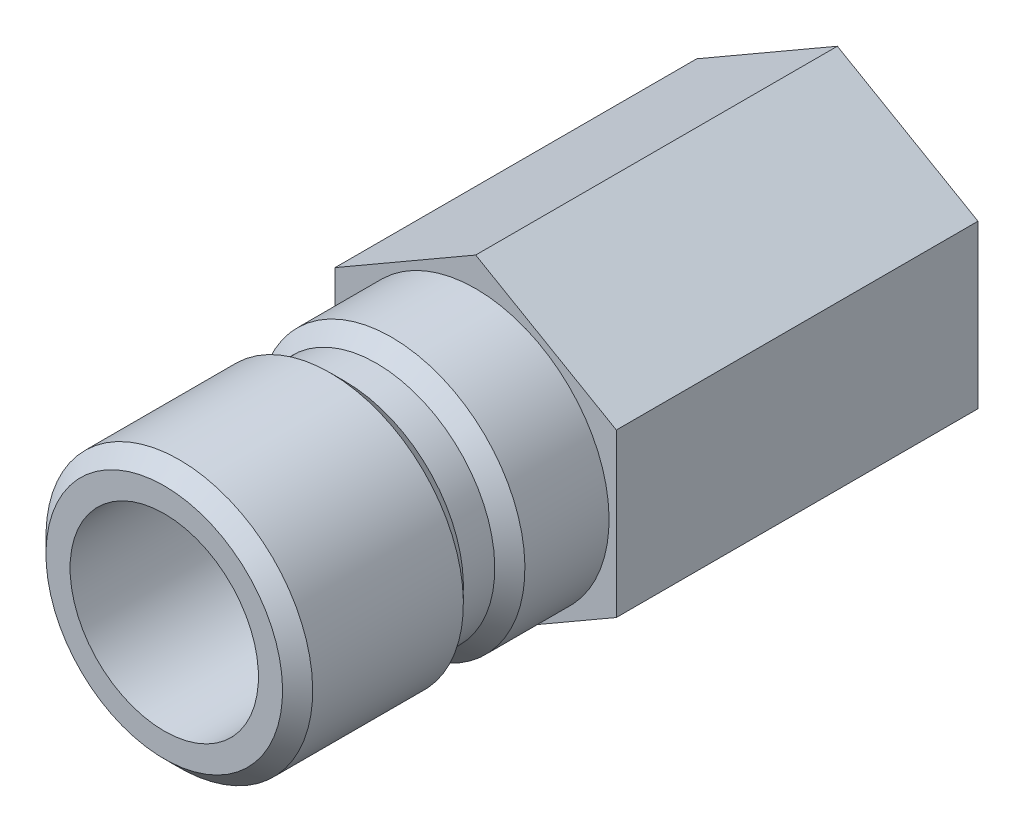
SolidWorks part; units mm, degrees
ref_plane "Front Plane" through (0, 0, 0) normal (0, 0, 1) x (1, 0, 0)
ref_plane "Top Plane" through (0, 0, 0) normal (0, 1, 0) x (1, 0, 0)
ref_plane "Right Plane" through (0, 0, 0) normal (1, 0, 0) x (0, 0, -1)
sketch "Sketch1" plane through (0, 0, 0) normal (1, 0, 0) x (0, 0, -1)
  line L0 (0, 0) -> (-18.923, 0) construction
  line L1 (-15.748, 4.7625) -> (-15.748, 5.9817)
  line L2 (-6.604, 5.9817) -> (-6.604, 0) construction
  line L3 (-14.986, 6.7437) -> (-7.366, 6.7437)
  line L4 (0, 8.7312) -> (0, 0) construction
  line L5 (-6.604, 5.9817) -> (-5.0165, 5.9817)
  line L6 (-4.2545, 6.7437) -> (0, 6.7437)
  line L7 (0, 6.7437) -> (0, 8.7312)
  line L8 (-6.604, 5.9817) -> (-7.366, 6.7437)
  line L9 (-5.0165, 5.9817) -> (-4.2545, 6.7437)
  line L10 (-15.748, 5.9817) -> (-14.986, 6.7437)
  line L11 (-15.748, 4.7625) -> (6.6675, 4.7625)
  line L12 (0, 8.7312) -> (18.288, 8.7312)
  line L13 (6.6675, 4.7625) -> (6.6675, 5.588)
  line L14 (18.288, 8.7312) -> (18.288, 5.9511)
  line L15 (6.6675, 5.588) -> (18.288, 5.9511)
  dimension "D1" = 15.748
  dimension "D2" = 1.5875
  dimension "D3" = 0.762
  dimension "D4" = 45
  dimension "D5" = 9.144
  dimension "D6" = 45
  dimension "D7" = 17.4625
  dimension "D8" = 9.525
  dimension "D9" = 34.036
  dimension "D10" = 3.175
  dimension "D11" = 11.176
  dimension "D12" = 11.6205
  dimension "D13" = 1.79
  dimension "D14" = 13.4874
revolve "Revolve1" add sketch "Sketch1" angle 360 about L0
sketch "Sketch2" plane through (0, 0, 0) normal (0, 0, 1) x (1, 0, 0)
  line L1 (-7.112, 4.1061) -> (-7.112, -4.1061)
  line L2 (-7.112, -4.1061) -> (0, -8.2122)
  line L3 (0, -8.2122) -> (7.112, -4.1061)
  line L4 (7.112, -4.1061) -> (7.112, 4.1061)
  line L5 (7.112, 4.1061) -> (0, 8.2122)
  line L6 (0, 8.2122) -> (-7.112, 4.1061)
  circle A0 centre (0, 0) radius 7.112 construction
  dimension "D1" = 14.224
extrude "Cut-Extrude1" cut sketch "Sketch2" against normal through all flip side to cut
